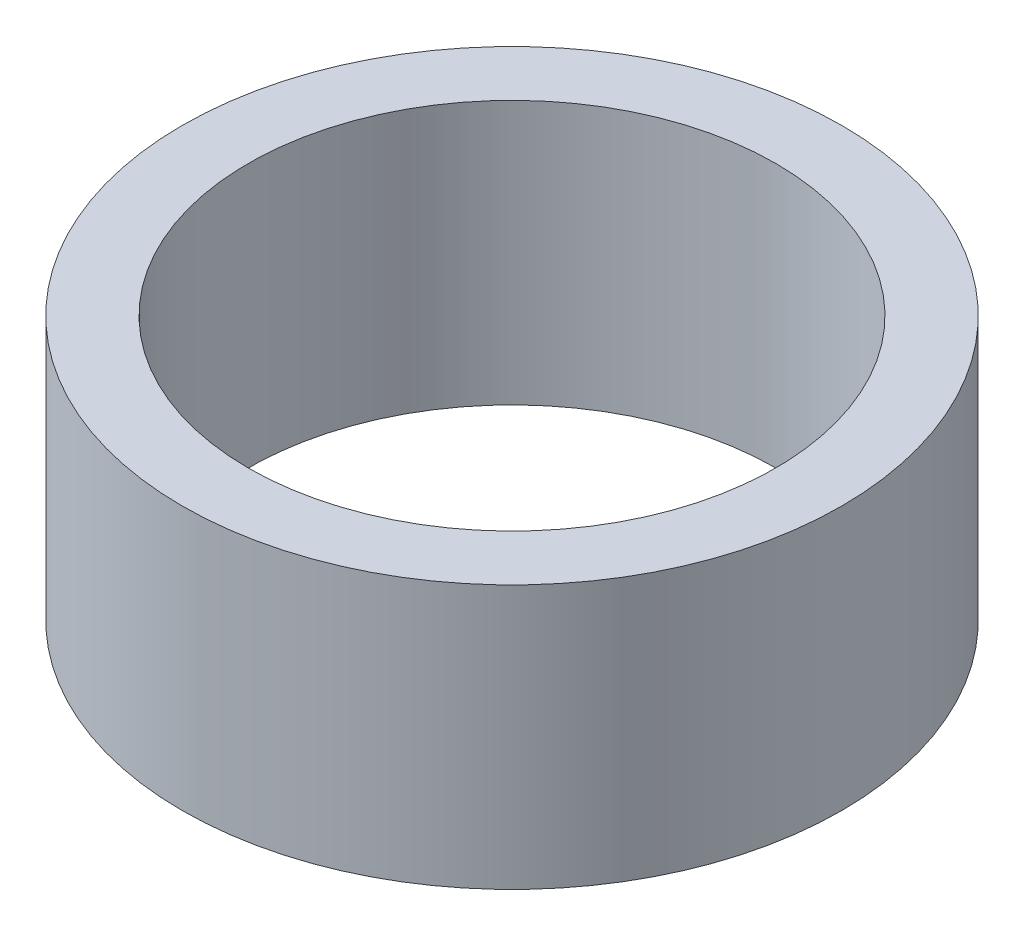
SolidWorks part; units mm, degrees
ref_plane "Alzado" through (0, 0, 0) normal (0, 0, 1) x (1, 0, 0)
ref_plane "Planta" through (0, 0, 0) normal (0, 1, 0) x (1, 0, 0)
ref_plane "Vista lateral" through (0, 0, 0) normal (1, 0, 0) x (0, 0, -1)
sketch "Croquis1" plane through (0, 0, 0) normal (0, 1, 0) x (1, 0, 0)
  circle A0 centre (0, 0) radius 25
  circle A1 centre (0, 0) radius 20
  dimension "D1" = 50
  dimension "D2" = 40
extrude "Saliente-Extruir1" add sketch "Croquis1" along normal blind 20
